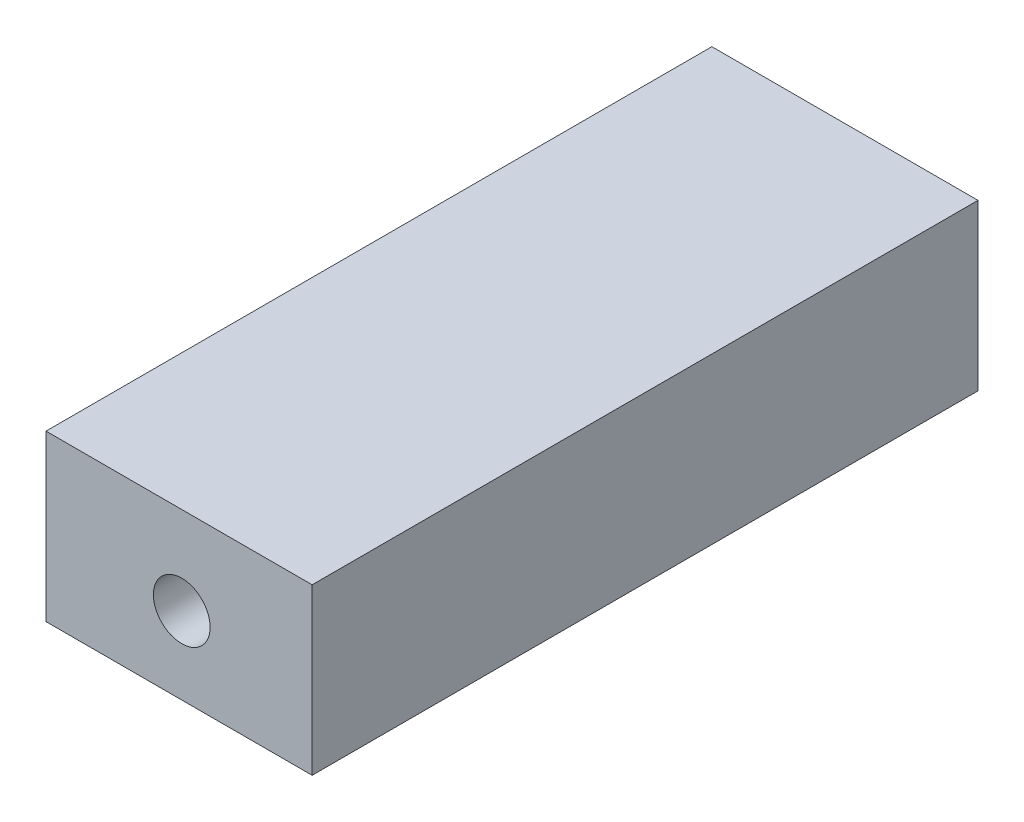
SolidWorks part; units mm, degrees
ref_plane "Front" through (0, 0, 0) normal (0, 0, 1) x (1, 0, 0)
ref_plane "Top" through (0, 0, 0) normal (0, 1, 0) x (1, 0, 0)
ref_plane "Right" through (0, 0, 0) normal (1, 0, 0) x (0, 0, -1)
sketch "Sketch1" plane through (0, 0, 0) normal (0, 0, 1) x (1, 0, 0)
  line L1 (0, 0) -> (12.6905, 0)
  line L2 (0, 0) -> (0, 7.8681)
  line L3 (0, 7.8681) -> (12.6905, 7.8681)
  line L4 (12.6905, 0) -> (12.6905, 7.8681)
extrude "Extrude1" add sketch "Sketch1" along normal blind 31.75
hole_wizard "Tap Drill for #6 Tap1" positions "3DSketch2" profile "Sketch4" hole size "#6-32" standard "Ansi Inch"
sketch3d "3DSketch2"
  point P1 (6.4731, 3.6798, 31.75)
sketch "Sketch4" plane through (6.4731, 3.6798, 31.75) normal (1, 0, 0) x (0, -1, 0)
  line L0 (0, 0) -> (0, 10.9727)
  line L1 (0, 10.9727) -> (1.3525, 10.16)
  line L2 (1.3525, 10.16) -> (1.3525, 0)
  line L5 (1.3525, 0) -> (0, 0)
  line L10 (0, 10.9727) -> (-1.3526, 10.16) construction
  line L11 (0, -6.35) -> (0, 107.95) construction
  dimension "Hole Dia." = 2.7051
  dimension "Hole Depth" = 10.16
  dimension "Drill Angle" = 118
